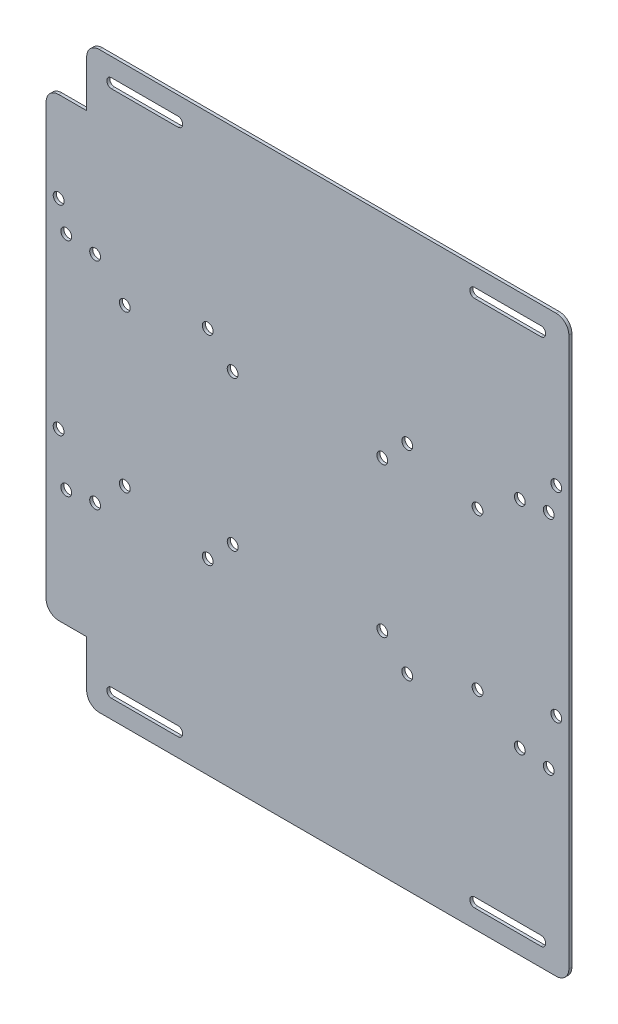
SolidWorks part; units mm, degrees
ref_plane "Front Plane" through (0, 0, 0) normal (0, 0, 1) x (1, 0, 0)
ref_plane "Top Plane" through (0, 0, 0) normal (0, 1, 0) x (1, 0, 0)
ref_plane "Right Plane" through (0, 0, 0) normal (1, 0, 0) x (0, 0, -1)
sketch "Model" plane through (0, 0, 0) normal (0, 0, 1) x (1, 0, 0)
  line L0 (277.0259, 436.7763) -> (505.9815, 436.7763)
  line L1 (512.3315, 430.4263) -> (512.3315, 155.3443)
  line L2 (277.0259, 148.9943) -> (505.9815, 148.9943)
  line L3 (250.3559, 400.7083) -> (250.3559, 185.0623)
  line L4 (256.7059, 407.0583) -> (270.6759, 407.0583)
  line L5 (270.6759, 430.4263) -> (270.6759, 407.0583)
  line L6 (256.7059, 178.7123) -> (270.6759, 178.7123)
  line L7 (270.6759, 155.3443) -> (270.6759, 178.7123)
  line L8 (283.1481, 162.9985) -> (316.4221, 162.9985)
  line L9 (283.1481, 158.2233) -> (316.4221, 158.2233)
  line L10 (465.0842, 162.9985) -> (498.3582, 162.9985)
  line L11 (465.0842, 158.2233) -> (498.3582, 158.2233)
  line L12 (283.1481, 427.5472) -> (316.4221, 427.5472)
  line L13 (283.1481, 422.772) -> (316.4221, 422.772)
  line L14 (465.0842, 427.5472) -> (498.3582, 427.5472)
  line L15 (465.0842, 422.772) -> (498.3582, 422.772)
  circle A0 centre (418.8443, 255.3847) radius 2.7178
  circle A1 centre (343.8432, 255.3847) radius 2.7178
  circle A2 centre (343.8432, 330.3859) radius 2.7178
  circle A3 centre (418.8443, 330.3859) radius 2.7178
  circle A4 centre (331.3438, 242.8854) radius 2.7178
  circle A5 centre (431.3436, 242.8854) radius 2.7178
  circle A6 centre (431.3436, 342.8852) radius 2.7178
  circle A7 centre (331.3438, 342.8852) radius 2.7178
  arc A8 (512.3315, 430.4263) -> (505.9815, 436.7763) centre (505.9815, 430.4263) ccw
  circle A9 centre (289.7793, 332.1359) radius 2.7178
  circle A10 centre (274.9177, 346.8603) radius 2.7178
  circle A11 centre (289.7793, 253.6347) radius 2.7178
  circle A12 centre (274.9177, 238.9103) radius 2.7178
  circle A13 centre (466.5582, 253.6347) radius 2.7178
  circle A14 centre (487.7697, 238.9103) radius 2.7178
  circle A15 centre (466.5582, 332.1359) radius 2.7178
  circle A16 centre (487.7697, 346.8603) radius 2.7178
  circle A17 centre (502.2477, 237.3355) radius 2.7178
  circle A18 centre (502.2477, 348.4351) radius 2.7178
  circle A19 centre (260.4397, 348.4351) radius 2.7178
  circle A20 centre (260.4397, 237.3355) radius 2.7178
  arc A21 (505.9815, 148.9943) -> (512.3315, 155.3443) centre (505.9815, 155.3443) ccw
  arc A22 (277.0259, 436.7763) -> (270.6759, 430.4263) centre (277.0259, 430.4263) ccw
  arc A23 (256.7059, 407.0583) -> (250.3559, 400.7083) centre (256.7059, 400.7083) ccw
  arc A24 (270.6759, 155.3443) -> (277.0259, 148.9943) centre (277.0259, 155.3443) ccw
  arc A25 (250.3559, 185.0623) -> (256.7059, 178.7123) centre (256.7059, 185.0623) ccw
  circle A26 centre (256.6297, 361.9733) radius 2.7178
  circle A27 centre (506.0577, 361.9733) radius 2.7178
  circle A28 centre (506.0577, 261.8973) radius 2.7178
  circle A29 centre (256.6297, 261.8973) radius 2.7178
  arc A30 (283.1481, 162.9985) -> (283.1481, 158.2233) centre (283.1481, 160.6109) ccw
  arc A31 (316.4221, 158.2233) -> (316.4221, 162.9985) centre (316.4221, 160.6109) ccw
  arc A32 (465.0842, 162.9985) -> (465.0842, 158.2233) centre (465.0842, 160.6109) ccw
  arc A33 (498.3582, 158.2233) -> (498.3582, 162.9985) centre (498.3582, 160.6109) ccw
  arc A34 (283.1481, 427.5472) -> (283.1481, 422.772) centre (283.1481, 425.1596) ccw
  arc A35 (316.4221, 422.772) -> (316.4221, 427.5472) centre (316.4221, 425.1596) ccw
  arc A36 (465.0842, 427.5472) -> (465.0842, 422.772) centre (465.0842, 425.1596) ccw
  arc A37 (498.3582, 422.772) -> (498.3582, 427.5472) centre (498.3582, 425.1596) ccw
  dimension "D1" = 5.4356
  dimension "D2" = 6.35
  dimension "D3" = 2.3876
  dimension "D9" = 148.9943
  dimension "D4" = 250.3559
  dimension "D5" = 256.6297
  dimension "D6" = 260.4397
  dimension "D7" = 270.6759
  dimension "D8" = 274.9177
  dimension "D10" = 283.1481
  dimension "D11" = 289.7793
  dimension "D12" = 316.4221
  dimension "D13" = 331.3438
  dimension "D14" = 343.8432
  dimension "D15" = 418.8443
  dimension "D16" = 431.3436
  dimension "D17" = 465.0842
  dimension "D18" = 466.5582
  dimension "D19" = 487.7697
  dimension "D21" = 502.2477
  dimension "D22" = 506.0577
  dimension "D23" = 512.3315
  dimension "D24" = 160.6109
  dimension "D25" = 178.7123
  dimension "D26" = 237.3355
  dimension "D27" = 238.9103
  dimension "D28" = 242.8854
  dimension "D29" = 253.6347
  dimension "D30" = 255.3847
  dimension "D31" = 261.8973
  dimension "D32" = 330.3859
  dimension "D33" = 332.1359
  dimension "D34" = 342.8852
  dimension "D35" = 346.8603
  dimension "D36" = 348.4351
  dimension "D37" = 361.9733
  dimension "D38" = 407.0583
  dimension "D39" = 425.1596
base flange "Base-Flange1" sketch "Model" thickness 1.5189 reverse thickness direction no parameters "D1"=0.2032
sketch "Bend-Lines1" [suppressed] plane through (0, 0, 0) normal (0, 1, 0) x (1, 0, 0)
sketch "Bounding-Box1" [suppressed] plane through (0, 0, 0) normal (0, 1, 0) x (1, 0, 0)
sheet metal parameters "Sheet-Metal1" thickness 1.5189 parameters "D1"=0.2032
flat pattern "Flat-Pattern1"
sketch "Bend-Lines2" plane through (0, 0, 0) normal (0, 1, 0) x (1, 0, 0)
sketch3d "Bounding-Box2" [suppressed]
  line L0 (6.35, -281.432, 0) -> (6.35, 6.35, 0) construction
  line L1 (-255.6256, -281.432, 0) -> (-255.6256, 6.35, 0) construction
  line L2 (6.35, -281.432, 0) -> (-255.6256, -281.432, 0) construction
  line L3 (6.35, 6.35, 0) -> (-255.6256, 6.35, 0) construction
